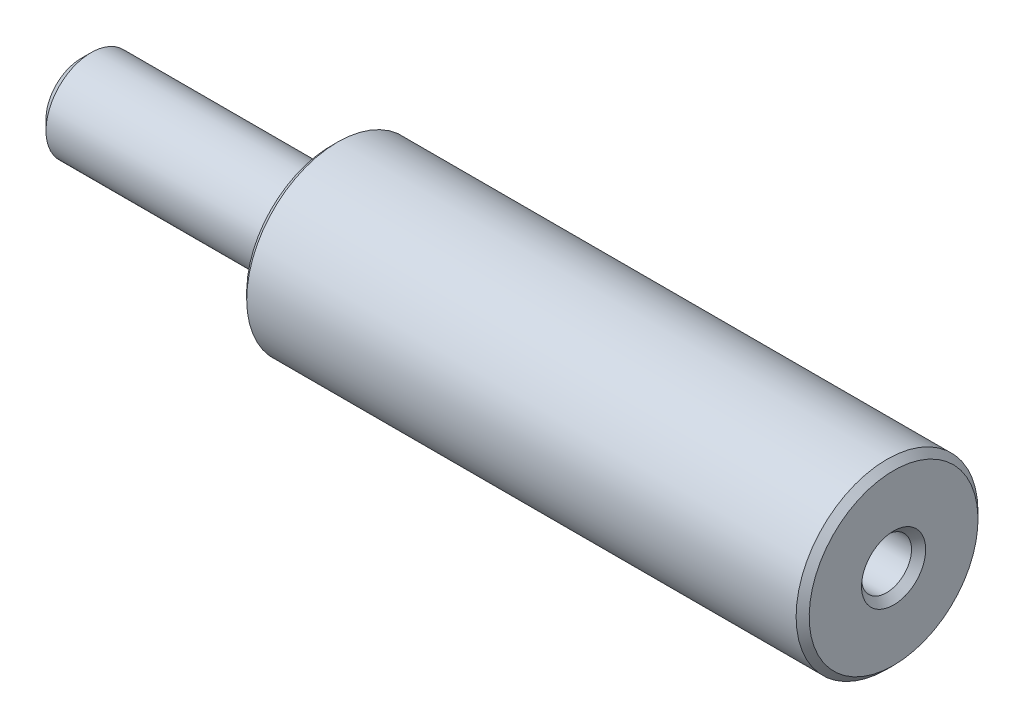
SolidWorks part; units mm, degrees
ref_plane "Front Plane" through (0, 0, 0) normal (0, 0, 1) x (1, 0, 0)
ref_plane "Top Plane" through (0, 0, 0) normal (0, 1, 0) x (1, 0, 0)
ref_plane "Right Plane" through (0, 0, 0) normal (1, 0, 0) x (0, 0, -1)
ref_plane "Plane1" through (0, 0, 0) normal (0, 0, -1) x (-1, 0, 0)
sketch "Sketch1" plane through (0, 0, 0) normal (0, 0, -1) x (-1, 0, 0)
  line L0 (-26.6017, 2) -> (-25.1163, 0)
  line L1 (-25.1163, 0) -> (20, 0)
  line L2 (20, 0) -> (20, 2.8105)
  line L3 (20, 2.8105) -> (19.1973, 3.6132)
  line L4 (19.1973, 3.6132) -> (0.314, 3.6132)
  line L5 (0, 3.9272) -> (0, 6.7527)
  line L6 (0, 6.7527) -> (-0.5233, 7.276)
  line L7 (-0.5233, 7.276) -> (-44.4767, 7.276)
  line L8 (-44.4767, 7.276) -> (-45, 6.7527)
  line L9 (-45, 6.7527) -> (-45, 2.5667)
  line L10 (-45, 2.5667) -> (-44.4333, 2)
  line L11 (-44.4333, 2) -> (-26.6017, 2)
  line L12 (-45, 0) -> (20, 0) construction
  arc A0 (0.314, 3.6132) -> (0, 3.9272) centre (0.314, 3.9272) cw
  dimension "D1" = 45
  dimension "D2" = 20
  dimension "D3" = 4
revolve "Revolve1" add sketch "Sketch1" angle 360 about L12
